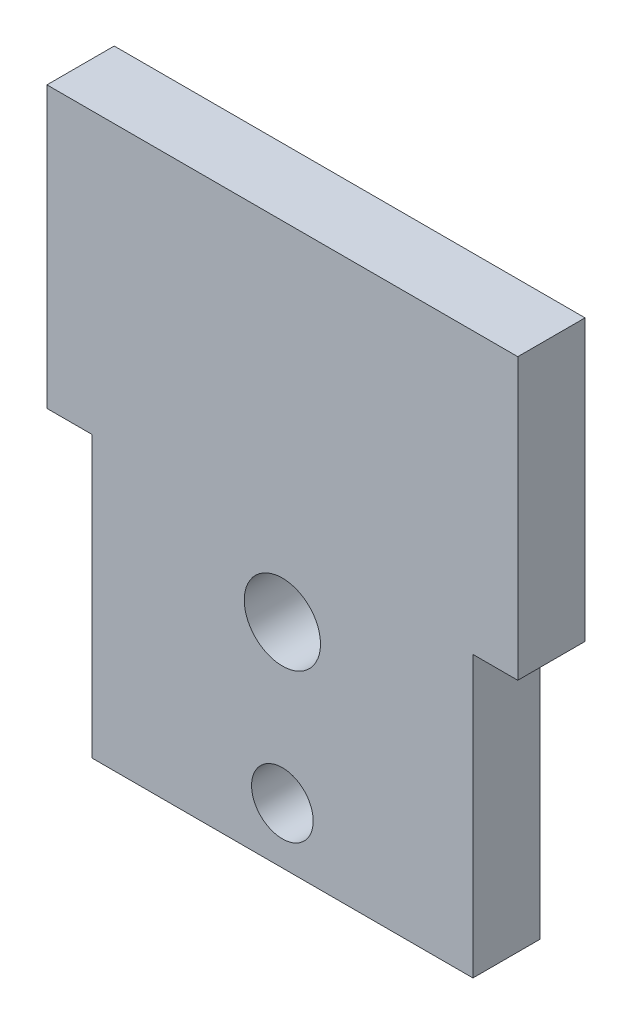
SolidWorks part; units mm, degrees
ref_plane "Front Plane" through (0, 0, 0) normal (0, 0, 1) x (1, 0, 0)
ref_plane "Top Plane" through (0, 0, 0) normal (0, 1, 0) x (1, 0, 0)
ref_plane "Right Plane" through (0, 0, 0) normal (1, 0, 0) x (0, 0, -1)
sketch "Sketch1" plane through (0, 0, 0) normal (0, 0, 1) x (1, 0, 0)
  line L0 (0, 0) -> (0, 25)
  line L1 (0, 25) -> (-4, 25)
  line L2 (-4, 25) -> (-4, 50)
  line L3 (-4, 50) -> (38, 50)
  line L4 (38, 50) -> (38, 25)
  line L5 (38, 25) -> (34, 25)
  line L6 (34, 25) -> (34, 0)
  line L7 (34, 0) -> (0, 0)
  line L8 (17, 0) -> (17, 50) construction
  circle A0 centre (17, 5) radius 2.75
  dimension "D6" = 5
  dimension "D7" = 5.5
  dimension "D1" = 42
  dimension "D2" = 34
  dimension "D3" = 25
  dimension "D4" = 25
  dimension "D5" = 25
extrude "Boss-Extrude1" add sketch "Sketch1" along normal blind 6
sketch "Sketch2" plane through (0, 0, 6) normal (0, 0, 1) x (1, 0, 0)
  line L0 (17, 0) -> (17, 50) construction
  line L1 (0, 0) -> (34, 0) construction
  line L2 (38, 50) -> (-4, 50) construction
  point P6 (17, 19)
  dimension "D1" = 19
hole_wizard "M8 Tapped Hole1" positions "3DSketch1" profile "Sketch3" tap size "M8" standard "DIN"
sketch3d "3DSketch1"
  point P0 (17, 19, 6)
sketch "Sketch3" plane through (17, 19, 6) normal (1, 0, 0) x (0, -1, 0)
  line L0 (0, 0) -> (0, 6)
  line L1 (0, 6) -> (3.4, 6)
  line L2 (3.4, 6) -> (3.4, 0)
  line L5 (3.4, 0) -> (0, 0)
  line L11 (0, -6.35) -> (0, 107.95) construction
  dimension "Thru Tap Drill Dia." = 6.8
  dimension "Thru Tap Drill Depth" = 6
